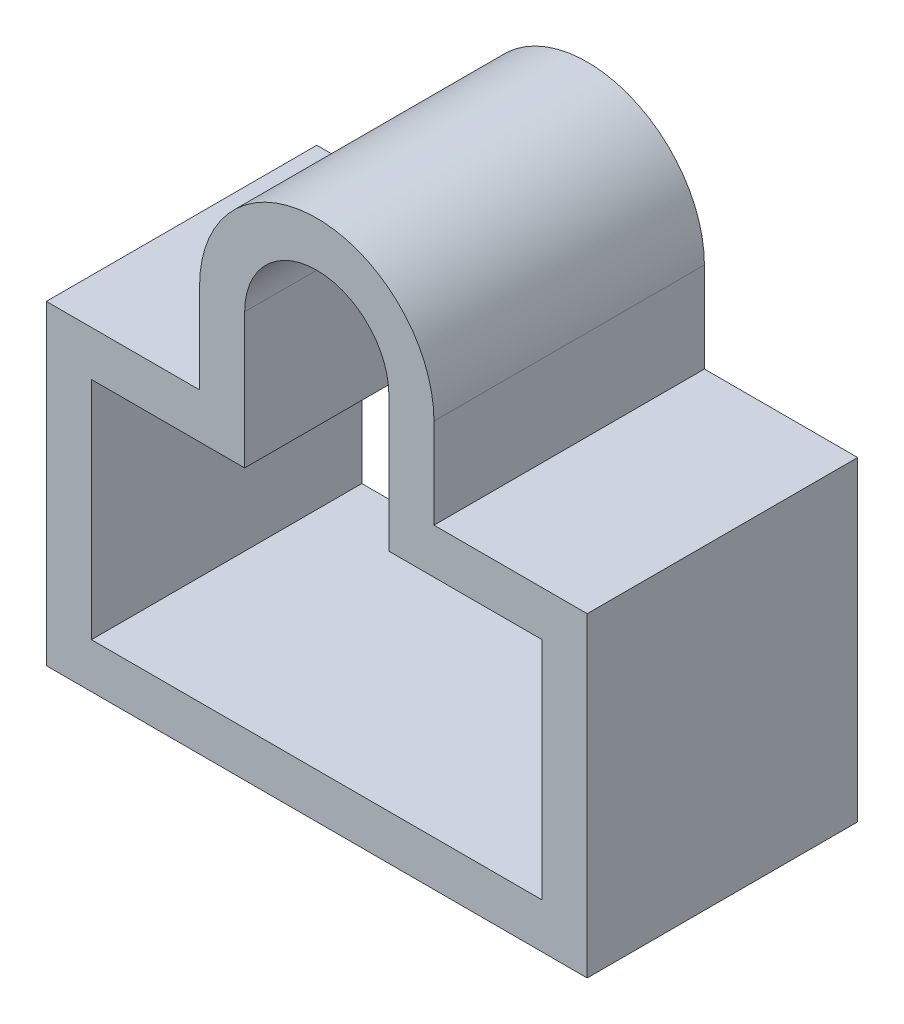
SolidWorks part; units mm, degrees
ref_plane "Front Plane" through (0, 0, 0) normal (0, 0, 1) x (1, 0, 0)
ref_plane "Top Plane" through (0, 0, 0) normal (0, 1, 0) x (1, 0, 0)
ref_plane "Right Plane" through (0, 0, 0) normal (1, 0, 0) x (0, 0, -1)
sketch "Sketch1" plane through (0, 0, 0) normal (0, 0, 1) x (1, 0, 0)
  line L0 (43, 35) -> (60, 35)
  line L1 (0, 35) -> (17, 35)
  line L2 (0, 35) -> (0, 0)
  line L3 (0, 0) -> (60, 0)
  line L4 (60, 35) -> (60, 0)
  line L5 (17, 35) -> (17, 45)
  line L7 (43, 45) -> (43, 35)
  arc A0 (43, 45) -> (17, 45) centre (30, 45) ccw
  dimension "D5" = 13
  dimension "D1" = 60
  dimension "D2" = 30
  dimension "D3" = 35
  dimension "D4" = 10
extrude "Extrude-Thin1" add sketch "Sketch1" along normal blind 30 thin
